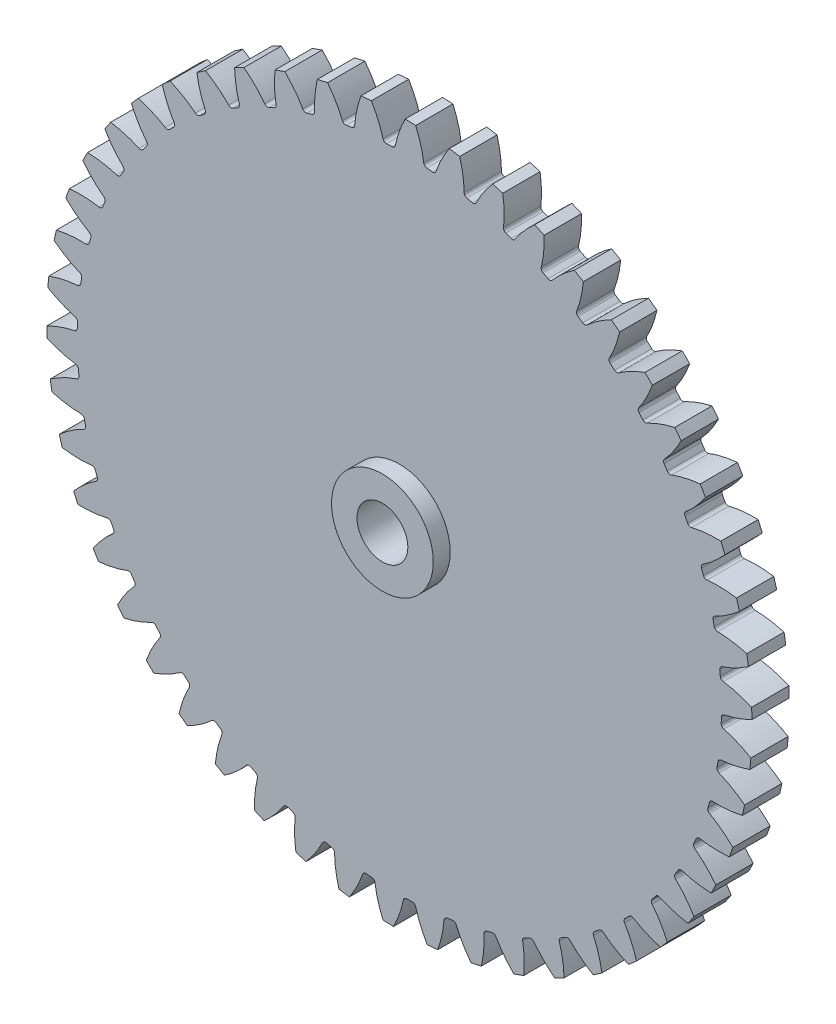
SolidWorks part; units mm, degrees
ref_plane "Face" through (0, 0, 0) normal (0, 0, 1) x (1, 0, 0)
ref_plane "Dessus" through (0, 0, 0) normal (0, 1, 0) x (1, 0, 0)
ref_plane "Droite" through (0, 0, 0) normal (1, 0, 0) x (0, 0, -1)
other "Joindre1"
other "Roue Z5 m=0,45 Z=18<1>@Z4-Z5"
other "Roue Z4 m=0,4 Z=50<1>@Z4-Z5"
sketch "Dp" plane through (0, 0, 0) normal (0, 0, -1) x (-1, 0, 0)
  circle A0 centre (0, 0) radius 4.05 construction
  circle A1 centre (0, 0) radius 7.5 construction
  dimension "D1" = 8.1
  dimension "D2" = 15
